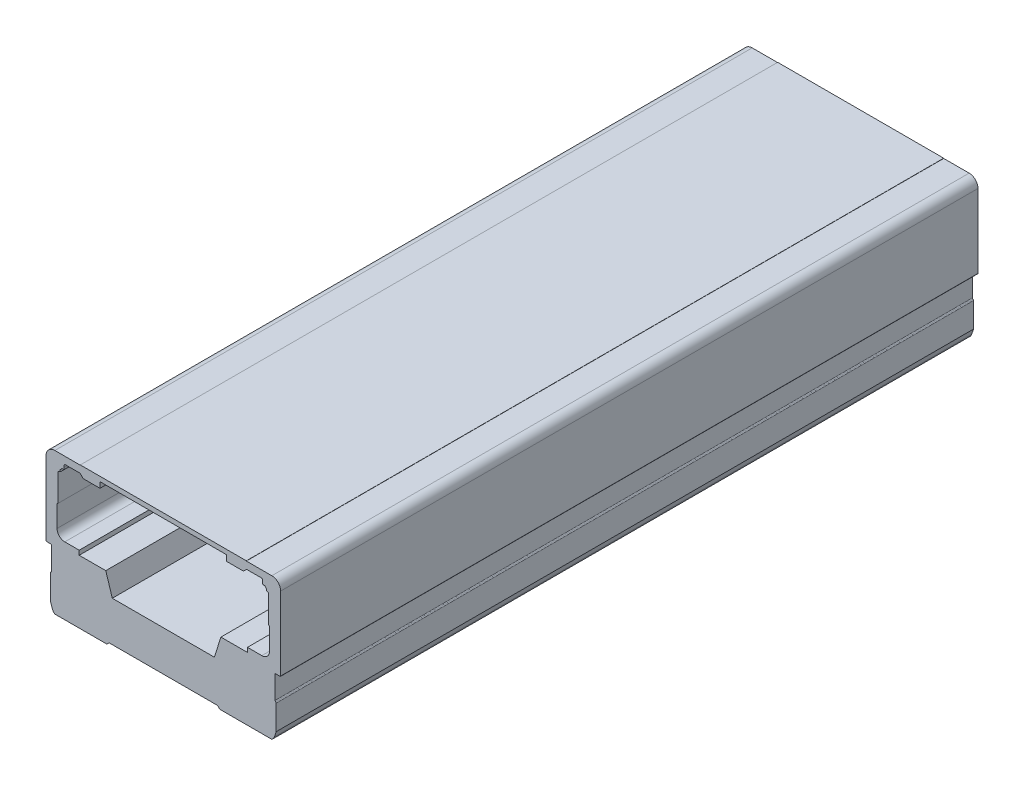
SolidWorks part; units mm, degrees
ref_plane "前视基准面" through (0, 0, 0) normal (0, 0, 1) x (1, 0, 0)
ref_plane "上视基准面" through (0, 0, 0) normal (0, 1, 0) x (1, 0, 0)
ref_plane "右视基准面" through (0, 0, 0) normal (1, 0, 0) x (0, 0, -1)
sketch "草图1" plane through (0, 0, 0) normal (0, 0, 1) x (1, 0, 0)
  line B0 (-47.6, 24.8371) -> (-48, 24.5371)
  line B1 (-47.6, 37.0752) -> (-47.6, 24.8371)
  line B2 (-46.7383, 38.5323) -> (-46.4578, 37.7807)
  line B3 (-45.0436, 39.1949) -> (-45.7952, 39.4754)
  line B4 (-44.8, 41.1371) -> (-44.8, 40.3371)
  line B5 (-37.6, 41.6371) -> (-44.3, 41.6371)
  line B6 (-36.2, 40.2371) -> (-37.6, 41.6371)
  line B7 (-28.6, 40.2371) -> (-36.2, 40.2371)
  line B8 (-28.6, 42.8371) -> (-28.6, 40.2371)
  line B9 (28.6, 42.8371) -> (-28.6, 42.8371)
  line B10 (28.6, 40.2371) -> (28.6, 42.8371)
  line B11 (36.2, 40.2371) -> (28.6, 40.2371)
  line B12 (37.6, 41.6371) -> (36.2, 40.2371)
  line B13 (44.3, 41.6371) -> (37.6, 41.6371)
  line B14 (44.8, 40.3371) -> (44.8, 41.1371)
  line B15 (45.7952, 39.4754) -> (45.0436, 39.1949)
  line B16 (46.4578, 37.7807) -> (46.7383, 38.5323)
  line B17 (47.6, 24.8371) -> (47.6, 37.0752)
  line B18 (48, 24.5371) -> (47.6, 24.8371)
  line B19 (48, 14.8371) -> (48, 24.5371)
  line B20 (38, 11.3371) -> (44.5, 11.3371)
  line B21 (38, 9.3371) -> (38, 11.3371)
  line B22 (26, 9.3371) -> (38, 9.3371)
  line B23 (23.056, 0) -> (26, 9.3371)
  line B24 (-23.056, 0) -> (23.056, 0)
  line B25 (-26, 9.3371) -> (-23.056, 0)
  line B26 (-38, 9.3371) -> (-26, 9.3371)
  line B27 (-38, 11.3371) -> (-38, 9.3371)
  line B28 (-44.5, 11.3371) -> (-38, 11.3371)
  line B29 (-48, 24.5371) -> (-48, 14.8371)
  line B30 (37.5, 44.8371) -> (37.5, 44.9371)
  line B31 (37.5, 44.9371) -> (-37.5, 44.9371)
  line B32 (-37.5, 44.9371) -> (-37.5, 44.8371)
  line B33 (-37.5, 44.8371) -> (-49, 44.8371)
  line B34 (-53, 40.8371) -> (-53, 7.6371)
  line B35 (-52.7, 7.3371) -> (-50.5, 7.3371)
  line B36 (-50.5, 7.3371) -> (-50.5, -3.1629)
  line B37 (-51, -4.0289) -> (-51, -15.1629)
  line B38 (-51, -15.1629) -> (-50.1378, -17.6669)
  line B39 (-49, -19.1629) -> (-25.5, -19.1629)
  line B40 (-25.5, -19.1629) -> (-24.5, -18.1629)
  line B41 (-24.5, -18.1629) -> (24.5, -18.1629)
  line B42 (24.5, -18.1629) -> (25.5, -19.1629)
  line B43 (25.5, -19.1629) -> (49, -19.1629)
  line B44 (50.1365, -17.6706) -> (51, -15.1629)
  line B45 (51, -15.1629) -> (51, -4.0289)
  line B46 (50.5, -3.1629) -> (50.5, 7.3371)
  line B47 (50.5, 7.3371) -> (52.7, 7.3371)
  line B48 (53, 7.6371) -> (53, 40.8371)
  line B49 (49, 44.8371) -> (37.5, 44.8371)
  arc B50 (-47.1758, 37.5695) -> (-47.6, 37.0752) centre (-47.1, 37.0752) ccw
  arc B51 (-47.1758, 37.5695) -> (-46.4578, 37.7807) centre (-47.6, 40.3371) ccw
  arc B52 (-46.7383, 38.5323) -> (-45.7952, 39.4754) centre (-47.6, 40.3371) ccw
  arc B53 (-45.0436, 39.1949) -> (-44.8, 40.3371) centre (-47.6, 40.3371) ccw
  arc B54 (-44.3, 41.6371) -> (-44.8, 41.1371) centre (-44.3, 41.1371) ccw
  arc B55 (44.8, 41.1371) -> (44.3, 41.6371) centre (44.3, 41.1371) ccw
  arc B56 (44.8, 40.3371) -> (45.0436, 39.1949) centre (47.6, 40.3371) ccw
  arc B57 (45.7952, 39.4754) -> (46.7383, 38.5323) centre (47.6, 40.3371) ccw
  arc B58 (46.4578, 37.7807) -> (47.1758, 37.5695) centre (47.6, 40.3371) ccw
  arc B59 (47.6, 37.0752) -> (47.1758, 37.5695) centre (47.1, 37.0752) ccw
  arc B60 (44.5, 11.3371) -> (48, 14.8371) centre (44.5, 14.8371) ccw
  arc B61 (-48, 14.8371) -> (-44.5, 11.3371) centre (-44.5, 14.8371) ccw
  arc B62 (-49, 44.8371) -> (-53, 40.8371) centre (-49, 40.8371) ccw
  arc B63 (-53, 7.6371) -> (-52.7, 7.3371) centre (-52.7, 7.6371) ccw
  arc B64 (-50.75, -3.5959) -> (-50.5, -3.1629) centre (-51, -3.1629) ccw
  arc B65 (-50.75, -3.5959) -> (-51, -4.0289) centre (-50.5, -4.0289) ccw
  arc B66 (-50.1378, -17.6669) -> (-49, -19.1629) centre (-47.3012, -16.6902) ccw
  arc B67 (49, -19.1629) -> (50.1365, -17.6706) centre (47.3012, -16.6902) ccw
  arc B68 (51, -4.0289) -> (50.75, -3.5959) centre (50.5, -4.0289) ccw
  arc B69 (50.5, -3.1629) -> (50.75, -3.5959) centre (51, -3.1629) ccw
  arc B70 (52.7, 7.3371) -> (53, 7.6371) centre (52.7, 7.6371) ccw
  arc B71 (53, 40.8371) -> (49, 44.8371) centre (49, 40.8371) ccw
sketch_block_instance "块1-1"
sketch_block "块1"
extrude "凸台-拉伸1" add sketch "草图1" along normal blind 315
hole_wizard "M5 螺纹孔1" positions "草图2" profile "草图3" tap size "M5" standard "GB"
sketch "草图2" plane through (0, -19.1629, 0) normal (0, -1, 0) x (-1, 0, 0)
  line L0 (0, -315) -> (0, -464.3791) construction
  line L1 (24.5, -315) -> (-24.5, -315) construction
  line L2 (49, -315) -> (25.5, -315) construction
  point P0 (42.5, -284.5)
  point P9 (-42.5, -284.5)
  point P13 (42.5, -234.5)
  point P15 (42.5, -34.5)
  point P17 (42.5, 165.5)
  point P19 (42.5, 365.5)
  point P21 (42.5, 565.5)
  point P23 (42.5, 765.5)
  point P27 (-42.5, 565.5)
  point P28 (-42.5, 365.5)
  point P29 (-42.5, 165.5)
  point P30 (-42.5, -34.5)
  point P31 (-42.5, -234.5)
  dimension "D1" = 85
  dimension "D2" = 30.5
  dimension "D3" = 50
  dimension "D4" = 200
  dimension "D5" = 200
  dimension "D6" = 200
  dimension "D7" = 200
  dimension "D8" = 200
sketch "草图3" plane through (-42.5, -19.1629, 284.5) normal (1, 0, 0) x (0, 0, -1)
  line L0 (0, 0) -> (0, 12.6618)
  line L1 (0, 12.6618) -> (2.1, 11.4)
  line L2 (2.1, 11.4) -> (2.1, 0)
  line L5 (2.1, 0) -> (0, 0)
  line L10 (0, 12.6618) -> (-2.1, 11.4) construction
  line L11 (0, -6.35) -> (0, 107.95) construction
  dimension "螺纹孔钻头直径" = 4.2
  dimension "螺纹孔钻头深度" = 11.4
  dimension "导头角度" = 118
